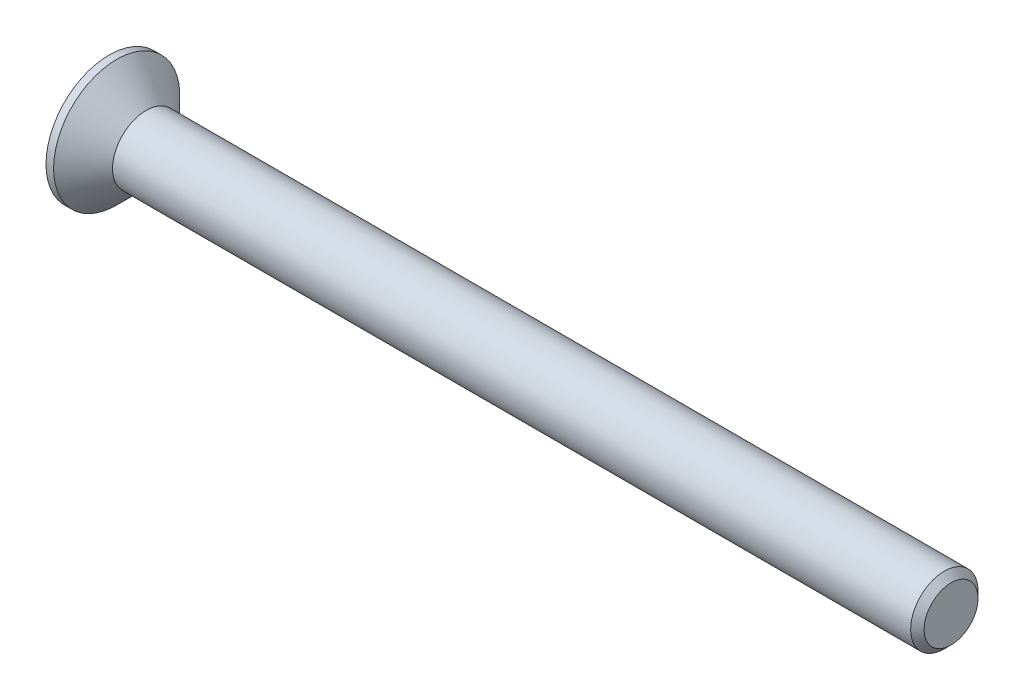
SolidWorks part; units mm, degrees
ref_plane "Front Plane" through (0, 0, 0) normal (0, 0, 1) x (1, 0, 0)
ref_plane "Top Plane" through (0, 0, 0) normal (0, 1, 0) x (1, 0, 0)
ref_plane "Right Plane" through (0, 0, 0) normal (1, 0, 0) x (0, 0, -1)
sketch "Sketch1" plane through (0, 0, 0) normal (0, 0, 1) x (1, 0, 0)
  line L1 (-2.2, 3.75) -> (-2.2, 0)
  line L2 (-2.2, 0) -> (47.8, 0)
  line L3 (47.8, 0) -> (47.8, 2)
  line L4 (47.8, 2) -> (0, 2)
  line L5 (-2.2, 3.75) -> (-1.75, 3.75)
  line L6 (-1.75, 3.75) -> (0, 2)
  dimension "D1" = 2
  dimension "D2" = 45
  dimension "D3" = 2.2
  dimension "D4" = 50
  dimension "D5" = 3.75
revolve "Revolve1" add sketch "Sketch1" angle 360 about L2
chamfer "Chamfer1" distance 0.4 angle 45 1 edges at (47.8, 0, 2)
sketch "Sketch2" plane through (-2.2, 0, 0) normal (-1, 0, 0) x (0, 0, 1)
  line L0 (-0.55, 2.2) -> (0.55, 2.2)
  line L1 (0.55, 2.2) -> (0.55, 0.55)
  line L2 (0.55, 0.55) -> (2.2, 0.55)
  line L3 (2.2, 0.55) -> (2.2, -0.55)
  line L4 (2.2, -0.55) -> (0.55, -0.55)
  line L5 (0.55, -0.55) -> (0.55, -2.2)
  line L6 (0.55, -2.2) -> (-0.55, -2.2)
  line L7 (-0.55, -2.2) -> (-0.55, -0.55)
  line L8 (-0.55, -0.55) -> (-2.2, -0.55)
  line L9 (-2.2, -0.55) -> (-2.2, 0.55)
  line L10 (-2.2, 0.55) -> (-0.55, 0.55)
  line L11 (-0.55, 0.55) -> (-0.55, 2.2)
  point P2 (0, 2.2)
  point P14 (0, -2.2)
  point P15 (2.2, 0)
  point P16 (-2.2, 0)
  dimension "D1" = 4.4
  dimension "D2" = 1.1
extrude "Cut-Extrude1" cut sketch "Sketch2" against normal blind 1.9
